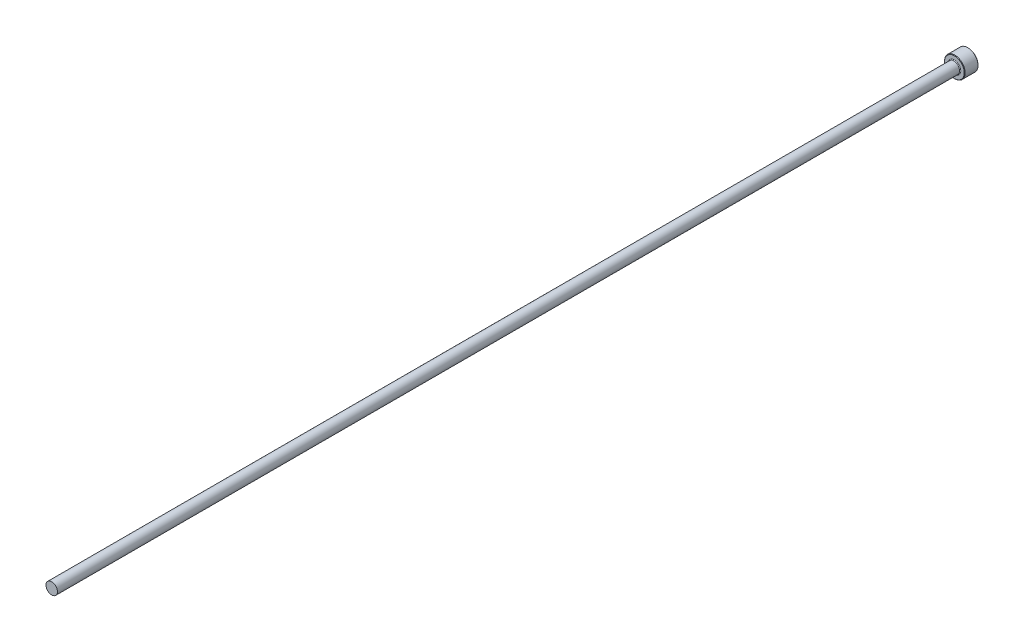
SolidWorks part; units mm, degrees
ref_plane "Front Plane" through (0, 0, 0) normal (0, 0, 1) x (1, 0, 0)
ref_plane "Top Plane" through (0, 0, 0) normal (0, 1, 0) x (1, 0, 0)
ref_plane "Right Plane" through (0, 0, 0) normal (1, 0, 0) x (0, 0, -1)
sketch "Sketch1" plane through (0, 0, 0) normal (1, 0, 0) x (0, 0, -1)
  line L0 (0, 0) -> (0, 4.5)
  line L1 (0, 4.95) -> (0, -4.95) construction
  line L2 (0, 4.5) -> (-6, 4.5)
  line L3 (-6, 4.5) -> (-6, 2.8)
  line L4 (-6.3, 2.5) -> (-400, 2.5)
  line L5 (-400, 2.5) -> (-400, 0)
  line L6 (4.95, 0) -> (-4.95, 0) construction
  line L7 (-400, 0) -> (0, 0)
  line L8 (-109.0506, 0) -> (16.9928, 0) construction
  arc A0 (-6, 2.8) -> (-6.3, 2.5) centre (-6.3, 2.8) cw
  dimension "D1" = 0.3
  dimension "D2" = 9
  dimension "D3" = 5
  dimension "D4" = 400
  dimension "D5" = 6
revolve "Revolve1" add sketch "Sketch1" angle 360 about L8
chamfer "Chamfer1" distance 0.2 angle 45 2 edges at (4.5, 0, 0) (4.5, 0, 6)
